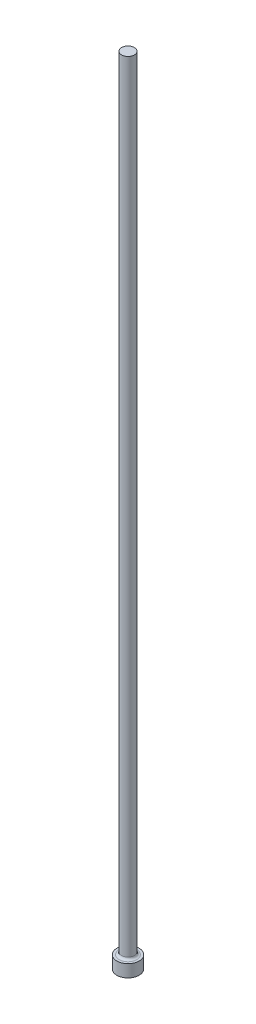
SolidWorks part; units mm, degrees
ref_plane "Front Plane" through (0, 0, 0) normal (0, 0, 1) x (1, 0, 0)
ref_plane "Top Plane" through (0, 0, 0) normal (0, 1, 0) x (1, 0, 0)
ref_plane "Right Plane" through (0, 0, 0) normal (1, 0, 0) x (0, 0, -1)
sketch "Sketch1" plane through (0, 0, 0) normal (0, 0, 1) x (1, 0, 0)
  line L0 (0, 0) -> (3.556, 0)
  line L1 (55, 0) -> (-55, 0) construction
  line L2 (3.556, 0) -> (3.556, 3.9624)
  line L3 (3.556, 3.9624) -> (2.8092, 3.9624)
  line L4 (2.0472, 4.7244) -> (2.0472, 254)
  line L5 (2.0472, 254) -> (0, 254)
  line L6 (0, 254) -> (0, 0)
  arc A0 (2.8092, 3.9624) -> (2.0472, 4.7244) centre (2.8092, 4.7244) cw
  dimension "D5" = 0.762
  dimension "D1" = 2.0472
  dimension "D2" = 3.556
  dimension "D3" = 3.9624
  dimension "D4" = 254
revolve "Revolve1" add sketch "Sketch1" angle 360 about L6
